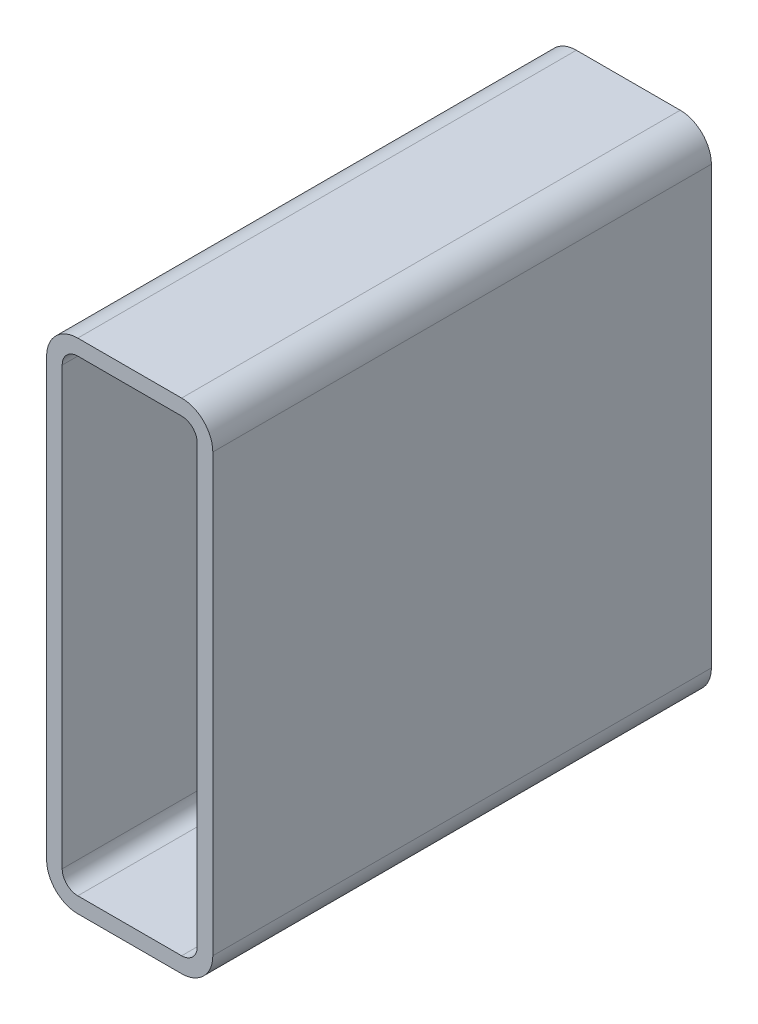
SolidWorks part; units mm, degrees
ref_plane "Front Plane" through (0, 0, 0) normal (0, 0, 1) x (1, 0, 0)
ref_plane "Top Plane" through (0, 0, 0) normal (0, 1, 0) x (1, 0, 0)
ref_plane "Right Plane" through (0, 0, 0) normal (1, 0, 0) x (0, 0, -1)
sketch "Sketch1" plane through (0, 0, 0) normal (0, 0, 1) x (1, 0, 0)
sketch_block_instance "HSS12x4x0.375-1"
sketch_block "HSS12x4x0.375"
extrude "Boss-Extrude1" add sketch "Sketch1" along normal blind 304.8
